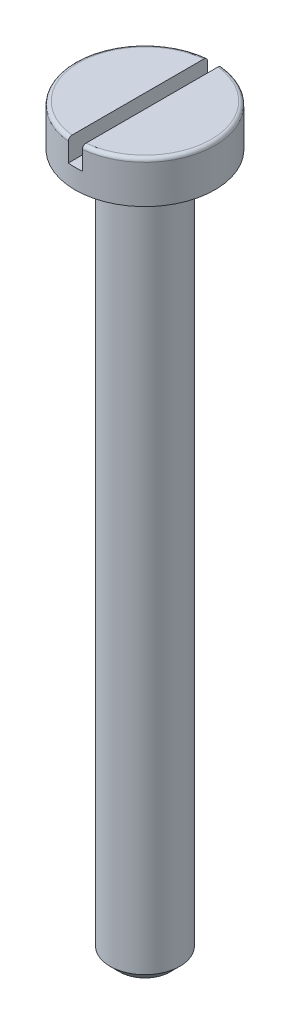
SolidWorks part; units mm, degrees
ref_plane "Face" through (0, 0, 0) normal (0, 0, 1) x (1, 0, 0)
ref_plane "Dessus" through (0, 0, 0) normal (0, 1, 0) x (1, 0, 0)
ref_plane "Droite" through (0, 0, 0) normal (1, 0, 0) x (0, 0, -1)
sketch "Esquisse1" plane through (0, 0, 0) normal (0, 1, 0) x (1, 0, 0)
  circle A0 centre (0, 0) radius 1.25
  dimension "Diamètre nominal" = 2.5
extrude "Base-Extrusion" add sketch "Esquisse1" against normal blind 25
chamfer "Chanfrein1" distance 0.35 angle 45 1 edges at (0, -25, 1.25)
sketch "Esquisse2" plane through (0, 0, 0) normal (0, 0, 1) x (1, 0, 0)
  line L0 (0, 1.5) -> (0, 0)
  line L2 (0, 0) -> (2.5, 0)
  line L4 (0, 1.5) -> (2.37, 1.5)
  line L5 (2.5, 0) -> (2.5, 1.37)
  line L7 (0, 1.3) -> (0, -25) construction
  line L8 (0, -24.65) -> (0, 0) construction
  line L9 (-0.9, -25) -> (0.9, -25) construction
  arc A0 (2.5, 1.37) -> (2.37, 1.5) centre (2.37, 1.37) ccw
  dimension "D2" = 0.13
  dimension "D1" = 5
  dimension "Hauteur tête" = 1.5
revolve "Boss.-Révol.1" add sketch "Esquisse2" angle 360 about L7
sketch "Esquisse3" plane through (0, 1.5, 0) normal (0, 1, 0) x (-1, 0, 0)
  line L0 (0, -2.5) -> (0, 2.5) construction
  line L1 (0.25, -2.5) -> (-0.25, -2.5)
  line L2 (0.25, 2.5) -> (-0.25, 2.5)
  line L3 (0.25, -2.5) -> (0.25, 2.5)
  line L4 (-0.25, -2.5) -> (-0.25, 2.5)
  circle A0 centre (0, 0) radius 2.5 construction
  dimension "Largeur fente" = 0.5
extrude "Enlèv. mat.-Extru.1" cut sketch "Esquisse3" against normal blind 0.8
